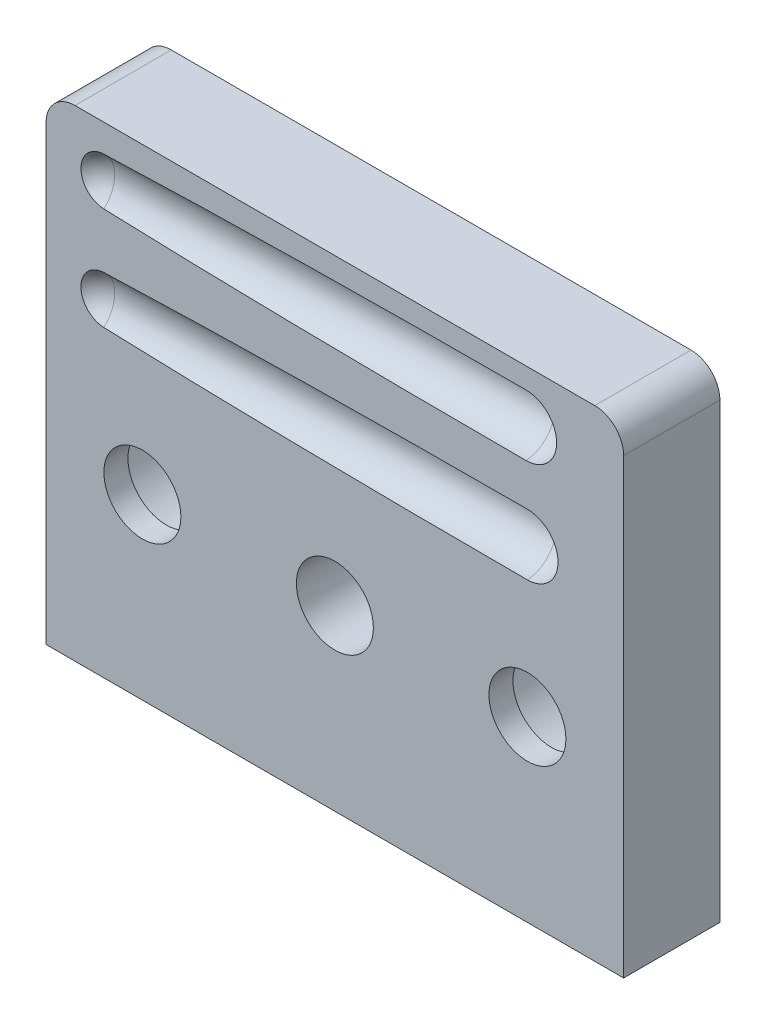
SolidWorks part; units mm, degrees
ref_plane "Plan1" through (0, 0, 0) normal (0, 0, 1) x (1, 0, 0)
ref_plane "Plan2" through (0, 0, 0) normal (0, 1, 0) x (1, 0, 0)
ref_plane "Plan3" through (0, 0, 0) normal (1, 0, 0) x (0, 0, -1)
sketch "Esquisse1" plane through (0, 0, 0) normal (0, 0, 1) x (1, 0, 0)
  line L0 (-30, -18.5) -> (30, -18.5)
  line L1 (-30, -18.5) -> (-30, 31.5)
  line L2 (30, 31.5) -> (-30, 31.5)
  line L3 (30, 31.5) -> (30, -18.5)
extrude "Base-Extrusion" add sketch "Esquisse1" along normal blind 10
fillet "Congé1" radius 3
sketch "Esquisse2" plane through (0, 0, 10) normal (0, 0, 1) x (1, 0, 0)
  circle A0 centre (-20, 0) radius 4
  circle A1 centre (0, 0) radius 4
  circle A2 centre (20, 0) radius 4
  dimension "D1" = 8
  dimension "D2" = 8
  dimension "D3" = 8
extrude "Enlèv. mat.-Extru.1" cut sketch "Esquisse2" against normal blind 10
sketch "Esquisse3" plane through (0, 0, 10) normal (0, 0, 1) x (1, 0, 0)
  line L0 (20, 22) -> (20, -14) construction
ref_plane "Plan5" through (0.4943, 0, 10.8857) normal (0.0454, 0, 0.999) x (0.999, 0, -0.0454)
sketch "Esquisse5" plane through (0, 0, 10) normal (0, 0, 1) x (1, 0, 0)
  line L0 (-24, 33) -> (-24, 5) construction
sketch "Esquisse6" plane through (0.4943, 0, 10.8857) normal (0.0454, 0, 0.999) x (0.999, 0, -0.0454)
  line L0 (-33, 26.1607) -> (36, 26.1607) construction
  line L3 (-24.4289, 33) -> (-24.4289, 5) construction
  line L4 (-24.4289, 29.3357) -> (19.3871, 29.3357)
  line L5 (22.5621, 26.1607) -> (-27.6039, 26.1607)
  arc A0 (19.3871, 29.3357) -> (22.5621, 26.1607) centre (19.3871, 26.1607) cw
  arc A1 (-24.4289, 29.3357) -> (-27.6039, 26.1607) centre (-24.4289, 26.1607) ccw
  dimension "D1" = 3.175
revolve "Enlever de la matière-Révolution1" cut sketch "Esquisse6" angle 360 about L0
sketch "Esquisse7" plane through (0.4943, 0, 10.8857) normal (0.0454, 0, 0.999) x (0.999, 0, -0.0454)
  line L0 (-34, 15.5) -> (32, 15.5) construction
  line L1 (26.5186, 31.5) -> (-27.4258, 31.5) construction
  line L2 (-24.4289, 12.32) -> (19.5258, 12.32)
  line L5 (-24.4289, 33) -> (-24.4289, 5) construction
  line L6 (19.5258, 22) -> (19.5258, -14) construction
  line L7 (22.7058, 15.5) -> (-27.6089, 15.5)
  arc A0 (19.5258, 12.32) -> (22.7058, 15.5) centre (19.5258, 15.5) ccw
  arc A1 (-24.4289, 12.32) -> (-27.6089, 15.5) centre (-24.4289, 15.5) cw
  dimension "D1" = 16
revolve "Enlever de la matière-Révolution2" cut sketch "Esquisse7" angle 360 about L0
sketch "Esquisse8" plane through (0, 0, 0) normal (0, 0, -1) x (-1, 0, 0)
  circle A0 centre (-20, 0) radius 6.75
  circle A1 centre (20, 0) radius 6.75
  dimension "D1" = 13.5
  dimension "D2" = 13.5
extrude "Enlèv. mat.-Extru.2" cut sketch "Esquisse8" against normal blind 7.5
sketch "Esquisse9" plane through (0, 0, 0) normal (0, 0, -1) x (-1, 0, 0)
  circle A0 centre (0, 0) radius 6.75
  dimension "D1" = 13.5
extrude "Enlèv. mat.-Extru.3" cut sketch "Esquisse9" against normal blind 4
